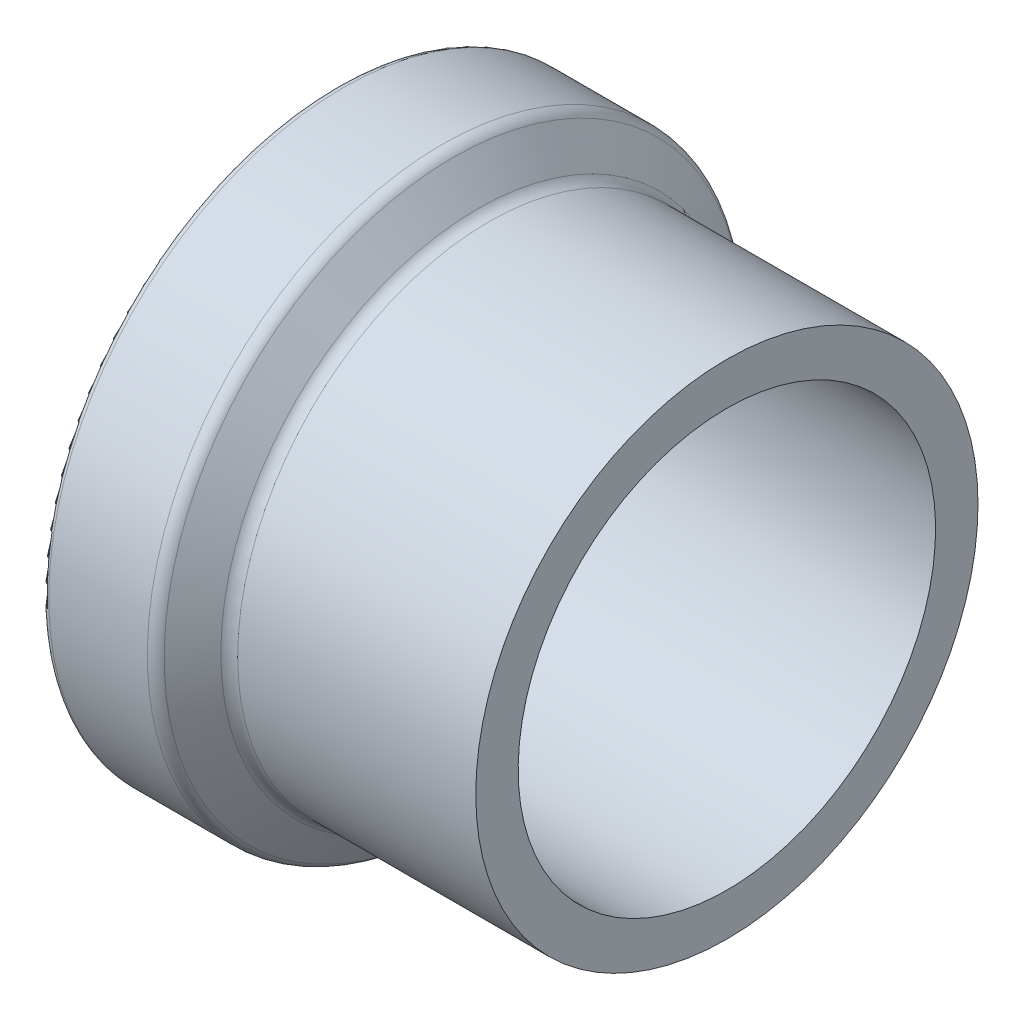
SolidWorks part; units mm, degrees
ref_plane "Front Plane" through (0, 0, 0) normal (0, 0, 1) x (1, 0, 0)
ref_plane "Top Plane" through (0, 0, 0) normal (0, 1, 0) x (1, 0, 0)
ref_plane "Right Plane" through (0, 0, 0) normal (1, 0, 0) x (0, 0, -1)
sketch "Sketch1" plane through (0, 0, 0) normal (0, 0, 1) x (1, 0, 0)
  line L0 (0, 0) -> (-52.2554, 0) construction
  line L1 (8.6604, 23.749) -> (-27.9918, 23.749)
  line L2 (-27.9918, 23.749) -> (-27.9918, 27.8003)
  line L3 (-28.8046, 28.6131) -> (-34.9768, 28.6131)
  line L4 (-35.7896, 29.4259) -> (-35.7896, 32.7152)
  line L5 (-34.9768, 33.528) -> (-23.7604, 33.528)
  line L6 (-22.4824, 32.8908) -> (-19.7104, 29.2122)
  line L7 (-18.4324, 28.575) -> (8.6604, 28.575)
  line L8 (8.6604, 28.575) -> (8.6604, 23.749)
  arc A0 (-34.9768, 33.528) -> (-35.7896, 32.7152) centre (-34.9768, 32.7152) ccw
  arc A1 (-35.7896, 29.4259) -> (-34.9768, 28.6131) centre (-34.9768, 29.4259) ccw
  arc A2 (-28.8046, 28.6131) -> (-27.9918, 27.8003) centre (-28.8046, 27.8003) cw
  arc A3 (-18.4324, 28.575) -> (-19.7104, 29.2122) centre (-18.4324, 30.1752) cw
  arc A4 (-22.4824, 32.8908) -> (-23.7604, 33.528) centre (-23.7604, 31.9278) ccw
  point P13 (-35.7896, 33.528)
  point P16 (-35.7896, 28.6131)
  point P23 (-22.9626, 33.528)
  dimension "D9" = 0.8128
  dimension "D10" = 1.6002
  dimension "D1" = 33.528
  dimension "D2" = 37
  dimension "D3" = 28.6131
  dimension "D4" = 23.749
  dimension "D5" = 12.827
  dimension "D6" = 7.7978
  dimension "D7" = 44.45
  dimension "D8" = 28.575
revolve "Revolve1" add sketch "Sketch1" angle 360 about L0
